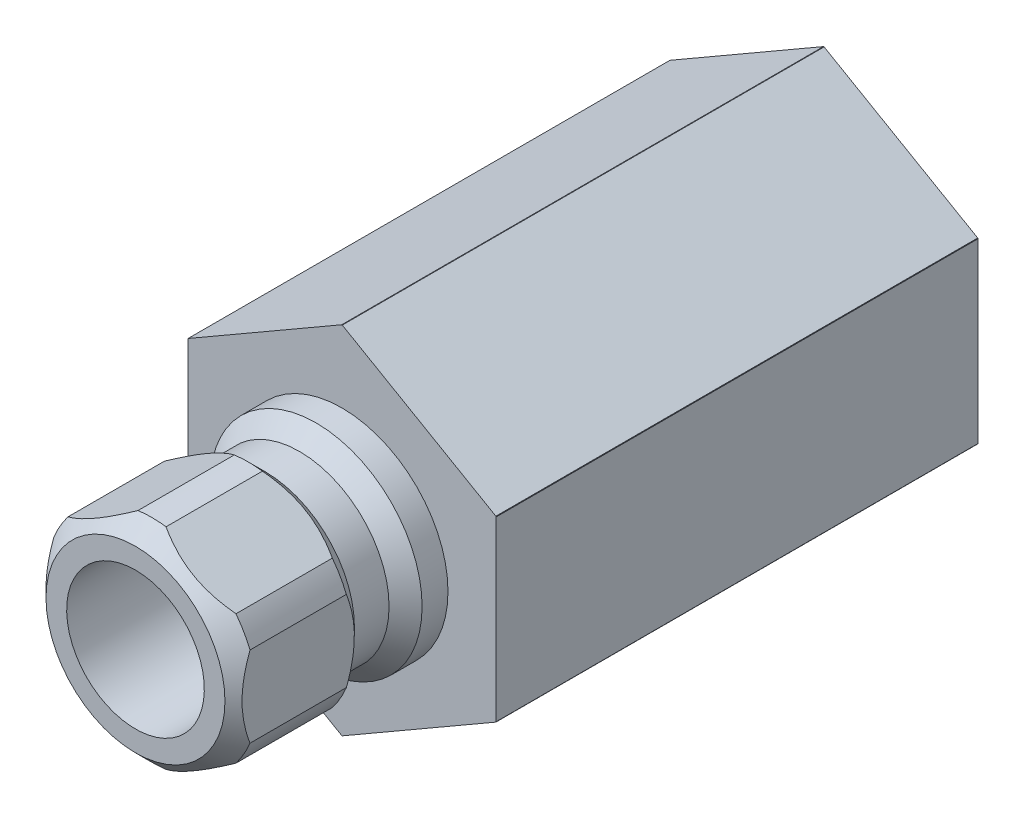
SolidWorks part; units mm, degrees
ref_plane "Front Plane" through (0, 0, 0) normal (0, 0, 1) x (1, 0, 0)
ref_plane "Top Plane" through (0, 0, 0) normal (0, 1, 0) x (1, 0, 0)
ref_plane "Right Plane" through (0, 0, 0) normal (1, 0, 0) x (0, 0, -1)
sketch "Sketch1" plane through (0, 0, 0) normal (1, 0, 0) x (0, 0, -1)
  line L0 (0, 0) -> (-12.7, 0) construction
  line L1 (-9.525, 3.175) -> (-9.525, 4.1275)
  line L2 (-3.556, 4.1275) -> (-3.556, 0) construction
  line L3 (-8.763, 4.8895) -> (-4.318, 4.8895)
  line L4 (0, 8.2042) -> (0, 0) construction
  line L5 (-3.556, 4.1275) -> (-1.9558, 4.1275)
  line L6 (-1.1938, 4.8895) -> (0, 4.8895)
  line L7 (0, 4.8895) -> (0, 8.2042)
  line L8 (-3.556, 4.1275) -> (-4.318, 4.8895)
  line L9 (-1.9558, 4.1275) -> (-1.1938, 4.8895)
  line L10 (-9.525, 4.1275) -> (-8.763, 4.8895)
  line L11 (-9.525, 3.175) -> (10.6045, 3.175)
  line L12 (0, 8.2042) -> (22.225, 8.2042)
  line L13 (10.6045, 3.175) -> (10.6045, 5.5563)
  line L14 (22.225, 8.2042) -> (22.225, 5.9194)
  line L15 (10.6045, 5.5563) -> (22.225, 5.9194)
  dimension "D11" = 11.6205
  dimension "D1" = 9.525
  dimension "D2" = 1.6002
  dimension "D3" = 0.762
  dimension "D4" = 45
  dimension "D5" = 5.969
  dimension "D6" = 45
  dimension "D7" = 11.1125
  dimension "D8" = 1.79
  dimension "D9" = 31.75
  dimension "D10" = 3.175
  dimension "D12" = 6.35
  dimension "D13" = 16.4084
  dimension "D14" = 9.779
revolve "Revolve1" add sketch "Sketch1" angle 360 about L0
sketch "Sketch2" plane through (0, 0, 0) normal (0, 0, 1) x (1, 0, 0)
  line L1 (-7.112, 4.1061) -> (-7.112, -4.1061)
  line L2 (-7.112, -4.1061) -> (0, -8.2122)
  line L3 (0, -8.2122) -> (7.112, -4.1061)
  line L4 (7.112, -4.1061) -> (7.112, 4.1061)
  line L5 (7.112, 4.1061) -> (0, 8.2122)
  line L6 (0, 8.2122) -> (-7.112, 4.1061)
  circle A0 centre (0, 0) radius 7.112 construction
  circle A1 centre (0, 0) radius 3.175 construction
  circle A2 centre (0, 0) radius 3.175
  dimension "D1" = 14.224
extrude "Cut-Extrude1" cut sketch "Sketch2" against normal through all flip side to cut
sketch "Sketch3" plane through (0, 0, 0) normal (0, 0, 1) x (1, 0, 0)
  line L1 (-4.5212, 2.6103) -> (-4.5212, -2.6103)
  line L2 (-4.5212, -2.6103) -> (0, -5.2206)
  line L3 (0, -5.2206) -> (4.5212, -2.6103)
  line L4 (4.5212, -2.6103) -> (4.5212, 2.6103)
  line L5 (4.5212, 2.6103) -> (0, 5.2206)
  line L6 (0, 5.2206) -> (-4.5212, 2.6103)
  circle A0 centre (0, 0) radius 4.5212 construction
  dimension "D1" = 9.0424
extrude "Cut-Extrude2" cut sketch "Sketch3" along normal through all from vertex at 3.556 flip side to cut
